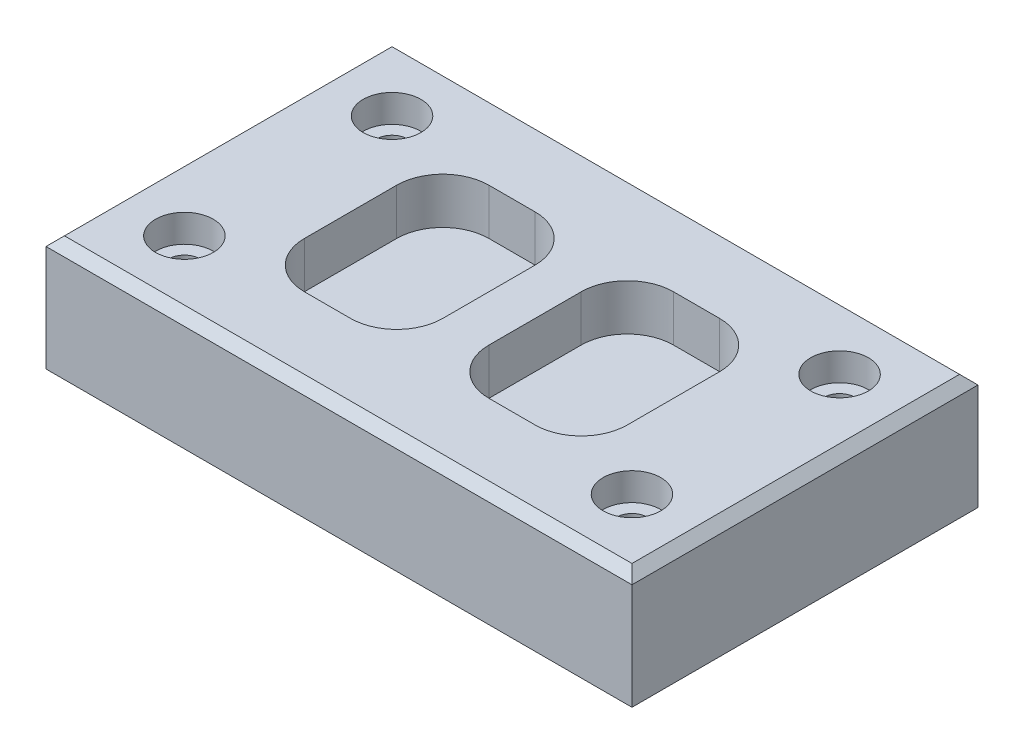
SolidWorks part; units mm, degrees
ref_plane "Front Plane" through (0, 0, 0) normal (0, 0, 1) x (1, 0, 0)
ref_plane "Top Plane" through (0, 0, 0) normal (0, 1, 0) x (1, 0, 0)
ref_plane "Right Plane" through (0, 0, 0) normal (1, 0, 0) x (0, 0, -1)
sketch "Sketch1" plane through (0, 0, 0) normal (0, 1, 0) x (1, 0, 0)
  line L1 (127, -75) -> (-127, -75)
  line L2 (127, -75) -> (127, 75)
  line L3 (127, 75) -> (-127, 75)
  line L4 (-127, -75) -> (-127, 75)
  line L5 (127, -75) -> (-127, 75) construction
  line L6 (127, 75) -> (-127, -75) construction
  point P0 (0, 0)
  dimension "D1" = 150
  dimension "D2" = 254
extrude "Boss-Extrude1" add sketch "Sketch1" along normal blind 50
sketch "Sketch2" plane through (0, 50, 0) normal (0, 1, 0) x (1, 0, 0)
  line L0 (-70, -20) -> (-70, 20)
  line L2 (-50, 40) -> (-30, 40)
  line L3 (-10, 20) -> (-10, -20)
  line L4 (-30, -40) -> (-50, -40)
  line L5 (0, 75) -> (0, -103.1024) construction
  line L6 (127, 75) -> (-127, 75) construction
  line L8 (-127, 75) -> (-127, -75) construction
  line L9 (50, 40) -> (30, 40)
  line L10 (70, -20) -> (70, 20)
  line L11 (30, -40) -> (50, -40)
  line L12 (10, 20) -> (10, -20)
  arc A0 (-70, 20) -> (-50, 40) centre (-50, 20) cw
  arc A1 (-30, 40) -> (-10, 20) centre (-30, 20) cw
  arc A2 (-10, -20) -> (-30, -40) centre (-30, -20) cw
  arc A3 (-70, -20) -> (-50, -40) centre (-50, -20) ccw
  arc A4 (30, 40) -> (10, 20) centre (30, 20) ccw
  arc A5 (70, 20) -> (50, 40) centre (50, 20) ccw
  arc A6 (70, -20) -> (50, -40) centre (50, -20) cw
  arc A7 (10, -20) -> (30, -40) centre (30, -20) ccw
  point P19 (-10, 0)
  point P22 (-127, 0)
  dimension "D1" = 20
  dimension "D2" = 60
  dimension "D3" = 20
  dimension "D4" = 80
  dimension "D5" = 10
extrude "Cut-Extrude1" cut sketch "Sketch2" against normal blind 20
hole_wizard "CBORE" positions "Sketch3" profile "Sketch5" counterbore size "M12" standard "ANSI Metric"
sketch "Sketch3" plane through (0, 50, 0) normal (0, 1, 0) x (1, 0, 0)
  line L0 (-127, 75) -> (-127, -75) construction
  line L1 (-127, -75) -> (127, -75) construction
  line L2 (127, -75) -> (127, 75) construction
  line L3 (127, 75) -> (-127, 75) construction
  point P0 (-97, -45)
  point P2 (-97, 45)
  point P4 (97, 45)
  point P6 (97, -45)
  dimension "D1" = 30
  dimension "D2" = 30
  dimension "D3" = 30
  dimension "D4" = 30
sketch "Sketch5" plane through (-97, 50, 45) normal (1, 0, 0) x (0, 0, 1)
  line L0 (0, 0) -> (0, 50)
  line L1 (0, 50) -> (6.75, 50)
  line L3 (6.75, 50) -> (6.75, 12)
  line L4 (6.75, 12) -> (12.5, 12)
  line L5 (12.5, 12) -> (12.5, 0)
  line L7 (12.5, 0) -> (0, 0)
  line L11 (0, -6.35) -> (0, 107.95) construction
  dimension "Thru Hole Dia." = 13.5
  dimension "Thru Hole Depth" = 50
  dimension "C'Bore Dia." = 25
  dimension "C'Bore Depth" = 12
chamfer "Chamfer1" distance 4 angle 45 4 edges at (0, 50, -75) (-127, 50, 0) (127, 50, 0) (0, 50, 75)
sketch "STOCK" plane through (0, 0, 0) normal (0, 1, 0) x (1, 0, 0)
  line L1 (175, -125) -> (-175, -125)
  line L2 (175, -125) -> (175, 125)
  line L3 (175, 125) -> (-175, 125)
  line L4 (-175, -125) -> (-175, 125)
  point P0 (0, 0)
  point P6 (0, 125)
  point P7 (-175, 0)
  dimension "D1" = 250
  dimension "D2" = 350
